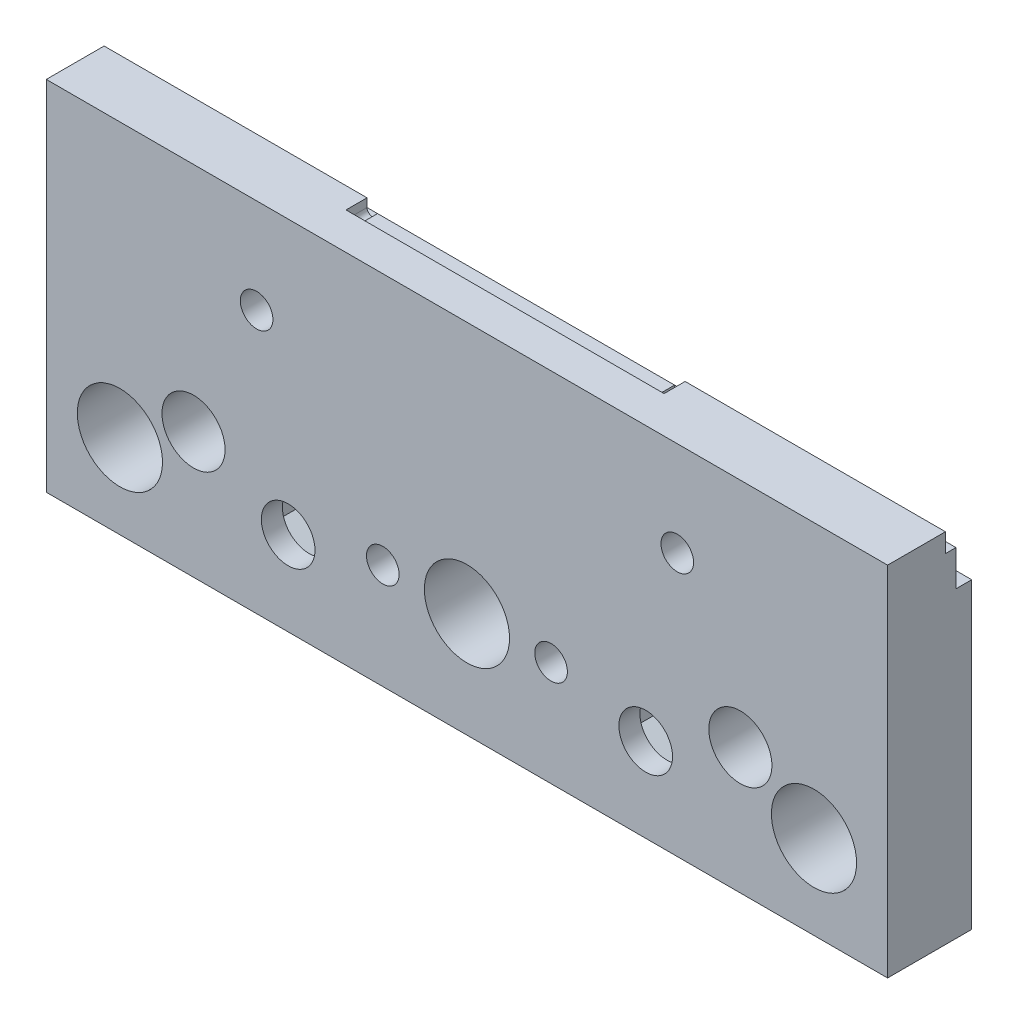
SolidWorks part; units mm, degrees
ref_plane "前视基准面" through (0, 0, 0) normal (0, 0, 1) x (1, 0, 0)
ref_plane "上视基准面" through (0, 0, 0) normal (0, 1, 0) x (1, 0, 0)
ref_plane "右视基准面" through (0, 0, 0) normal (1, 0, 0) x (0, 0, -1)
sketch "前视图草图" plane through (0, 0, 0) normal (0, 0, 1) x (1, 0, 0)
  line L0 (0, 0) -> (44.4821, 0) construction
  line L1 (0, 0) -> (0, 28.3185) construction
sketch "草图2" plane through (0, 0, 0) normal (0, 0, 1) x (1, 0, 0)
  line L0 (0, 0) -> (80, 0)
  line L1 (-200000, 0) -> (200044.4821, 0) construction
  line L2 (80, 0) -> (80, 34)
  line L3 (80, 34) -> (0, 34)
  line L4 (0, -200000) -> (0, 200028.3185) construction
  line L5 (0, 34) -> (0, 0)
  circle A0 centre (7, 8) radius 4.05
  circle A1 centre (40, 10) radius 4.05
  circle A2 centre (73, 8) radius 4.05
  dimension "D3" = 8
  dimension "D5" = 10
  dimension "D9" = 8.1
  dimension "D10" = 8.1
  dimension "D11" = 8.1
  dimension "D1" = 34
  dimension "D2" = 80
  dimension "D4" = 7
  dimension "D6" = 7
  dimension "D7" = 8
  dimension "D8" = 40
extrude "凸台-拉伸1" add sketch "草图2" along normal blind 8
sketch "草图3" plane through (0, 0, 8) normal (0, 0, 1) x (1, 0, 0)
  line L0 (16.088, 8) -> (31.4805, 8) construction
  line L1 (7, 8) -> (7, 16.8386) construction
  line L2 (73, 8) -> (73, 16.5917) construction
  line L4 (-200000, 0) -> (200044.4821, 0) construction
  circle A2 centre (23, 8) radius 2.55
  circle A3 centre (57, 8) radius 2.55
  dimension "D4" = 5.1
  dimension "D5" = 5.1
  dimension "D1" = 8
  dimension "D2" = 16
  dimension "D3" = 16
extrude "切除-拉伸1" cut sketch "草图3" against normal through all
sketch "草图4" plane through (80, 0, 0) normal (1, 0, 0) x (0, 0, -1)
  line L1 (0, -200000) -> (0, 200028.3185) construction
  line L2 (-1.5, 32.2) -> (-2.5, 32.2)
  line L3 (-2.5, 32.2) -> (-2.5, 34)
  line L4 (-8, 34) -> (0, 34) construction
  line L5 (-2.5, 34) -> (0, 34)
  line L6 (-1.5, 32.2) -> (-1.5, 28.8)
  line L7 (-1.5, 28.8) -> (0, 28.8)
  line L8 (0, 28.8) -> (0, 34)
  dimension "D1" = 3.4
  dimension "D2" = 2.5
  dimension "D3" = 1.5
  dimension "D4" = 1.8
extrude "切除-拉伸2" cut sketch "草图4" against normal through all
sketch "草图5" plane through (0, 0, 8) normal (0, 0, 1) x (1, 0, 0)
  line L0 (40, 10) -> (56.5376, 10) construction
  circle A0 centre (40, 10) radius 8 construction
  circle A1 centre (48, 10) radius 1.55
  circle A2 centre (32, 10) radius 1.55
  dimension "D1" = 3.1
  dimension "D2" = 3.1
  dimension "D3" = 16
extrude "切除-拉伸3" cut sketch "草图5" against normal through all
sketch "草图7" plane through (0, 0, 0) normal (0, 0, -1) x (-1, 0, 0)
  line L0 (-40, 12) -> (-40, -8.3696) construction
  line L1 (-23, 10) -> (-23, -2.3368) construction
  line L2 (200000, 0) -> (-200044.4821, 0) construction
  line L6 (-27.05, 10) -> (-27.05, 2.5)
  line L7 (-29.55, 0) -> (-16.45, 0)
  line L8 (-18.95, 2.5) -> (-18.95, 10)
  line L9 (-23, 8) -> (-23, 15.9045) construction
  line L13 (0, -200000) -> (0, 200028.3185) construction
  line L14 (-57, 8) -> (-57, 15.9045) construction
  line L15 (-57, 10) -> (-57, -2.3368) construction
  line L16 (-61.05, 2.5) -> (-61.05, 10)
  line L17 (-50.45, 0) -> (-63.55, 0)
  line L18 (-52.95, 10) -> (-52.95, 2.5)
  arc A1 (-18.95, 10) -> (-27.05, 10) centre (-23, 10) ccw
  arc A4 (-29.55, 0) -> (-27.05, 2.5) centre (-29.55, 2.5) ccw
  arc A5 (-18.95, 2.5) -> (-16.45, 0) centre (-16.45, 2.5) ccw
  arc A7 (-61.05, 2.5) -> (-63.55, 0) centre (-63.55, 2.5) cw
  arc A8 (-50.45, 0) -> (-52.95, 2.5) centre (-50.45, 2.5) cw
  arc A9 (-61.05, 10) -> (-52.95, 10) centre (-57, 10) cw
  dimension "D1" = 40
  dimension "D4" = 8.1
  dimension "D7" = 2.5
  dimension "D8" = 2.5
  dimension "D3" = 10
extrude "切除-拉伸4" [suppressed] cut sketch "草图7" against normal blind 6
sketch "草图8" plane through (0, 0, 0) normal (0, 0, -1) x (-1, 0, 0)
  line L0 (-40, 10) -> (-57.3165, 10) construction
  line L1 (-40, 20) -> (-40, 35.6562) construction
  line L2 (-30.5, 12.85) -> (-49.5, 12.85)
  line L3 (-49.5, 7.15) -> (-30.5, 7.15)
  line L4 (200000, 0) -> (-200044.4821, 0) construction
  line L5 (-80, 0) -> (-80, 28.8) construction
  line L6 (-48, 6.7091) -> (-45.15, 8.3546)
  line L7 (-45.15, 8.3546) -> (-45.15, 11.6454)
  line L8 (-45.15, 11.6454) -> (-48, 13.2909)
  line L9 (-48, 13.2909) -> (-50.85, 11.6454)
  line L10 (-50.85, 11.6454) -> (-50.85, 8.3546)
  line L11 (-50.85, 8.3546) -> (-48, 6.7091)
  line L12 (-34.85, 11.6454) -> (-34.85, 8.3546)
  line L13 (-34.85, 8.3546) -> (-32, 6.7091)
  line L14 (-32, 6.7091) -> (-29.15, 8.3546)
  line L15 (-29.15, 8.3546) -> (-29.15, 11.6454)
  line L16 (-29.15, 11.6454) -> (-32, 13.2909)
  line L17 (-32, 13.2909) -> (-34.85, 11.6454)
  arc A0 (-30.5, 7.15) -> (-30.5, 12.85) centre (-30.5, 10) ccw
  arc A1 (-49.5, 12.85) -> (-49.5, 7.15) centre (-49.5, 10) ccw
  circle A2 centre (-48, 10) radius 2.85 construction
  circle A3 centre (-32, 10) radius 2.85 construction
  dimension "D1" = 5.7
  dimension "D2" = 9.5
  dimension "D3" = 9.5
  dimension "D4" = 10
  dimension "D5" = 5.7
sketch "草图11" plane through (0, 0, 0) normal (0, 0, -1) x (-1, 0, 0)
  line L0 (0, 34) -> (-80, 34) construction
  line L1 (-80, 0) -> (-80, 28.8) construction
  line L2 (0, -200000) -> (0, 200028.3185) construction
  line L3 (-40, 20) -> (-40, 13.5744) construction
  line L4 (-28.772, 25) -> (-45.9396, 25) construction
  circle A0 centre (-60, 25) radius 1.55
  circle A1 centre (-20, 25) radius 1.55
  point P23 (-40, 20)
  dimension "D1" = 3.1
  dimension "D2" = 3.1
  dimension "D3" = 20
  dimension "D4" = 20
  dimension "D5" = 9
sketch "草图20" plane through (0, 0, 0) normal (0, 0, -1) x (-1, 0, 0)
  circle A0 centre (-40, 10) radius 5.5
  dimension "D1" = 11
extrude "切除-拉伸15" cut sketch "草图8" against normal blind 4.5 contours L10 L11 L6 L7 L8 L9 | L13 L14 L15 L16 L17 L12
extrude "切除-拉伸7" cut sketch "草图11" against normal through all contours A0 | A1
sketch "草图12" plane through (0, 0, 0) normal (0, 0, -1) x (-1, 0, 0)
  line L0 (-62.5, 22.15) -> (-57.5, 22.15)
  line L1 (-57.5, 27.85) -> (-62.5, 27.85)
  line L4 (-80, 0) -> (-80, 28.8) construction
  line L5 (-39.1423, 25) -> (-43.2672, 25) construction
  line L6 (-60, 21) -> (-60, 25.2385) construction
  line L7 (-20, 21) -> (-20, 26.1603) construction
  line L8 (-40, 20) -> (-40, 24.3689) construction
  line L9 (-17.5, 27.85) -> (-22.5, 27.85)
  line L10 (-22.5, 22.15) -> (-17.5, 22.15)
  line L11 (0, -200000) -> (0, 200028.3185) construction
  line L12 (0, 34) -> (-80, 34) construction
  arc A0 (-62.5, 27.85) -> (-62.5, 22.15) centre (-62.5, 25) ccw
  arc A1 (-57.5, 22.15) -> (-57.5, 27.85) centre (-57.5, 25) ccw
  arc A4 (-17.5, 22.15) -> (-17.5, 27.85) centre (-17.5, 25) ccw
  arc A5 (-22.5, 27.85) -> (-22.5, 22.15) centre (-22.5, 25) ccw
  point P16 (-38, 21)
  point P28 (-40, 25)
  dimension "D2" = 20
  dimension "D3" = 5
  dimension "D4" = 2.5
  dimension "D5" = 20
  dimension "D6" = 9
  dimension "D1" = 2
sketch "草图19" plane through (0, 0, 2.5) normal (0, 0, -1) x (-1, 0, 0)
  line L0 (0, 34) -> (-80, 34) construction
  line L1 (-25, 34) -> (-55.2479, 34)
  line L2 (-25, 34) -> (-25, 33.2)
  line L3 (-26, 33.2) -> (-54.2479, 33.2)
  line L4 (-55.2479, 34) -> (-55.2479, 33.2)
  line L5 (0, -200000) -> (0, 200028.3185) construction
  line L7 (0, 32.2) -> (-80, 32.2) construction
  line L8 (-56.3335, 32.7) -> (-52.9089, 32.7) construction
  line L9 (-55.2479, 1028.5823) -> (-55.2479, 33.2) construction
  line L10 (-25, 1028.5823) -> (-25, 32.7) construction
  line L11 (-55.2479, 32.7) -> (-55.2479, -973.3) construction
  line L12 (-25, 32.7) -> (-25, -973.3) construction
  arc A3 (-55.2479, 33.2) -> (-54.2479, 33.2) centre (-54.7479, 33.2) ccw
  arc A6 (-26, 33.2) -> (-25, 33.2) centre (-25.5, 33.2) ccw
  dimension "D3" = 1
  dimension "D4" = 1
  dimension "D2" = 0.8
  dimension "D1" = 0.5
  dimension "D9" = 25
extrude "切除-拉伸11" cut sketch "草图19" against normal blind 2
sketch "草图21" plane through (0, 0, 0) normal (0, 0, -1) x (-1, 0, 0)
  line L0 (-80, 12) -> (0, 12) construction
  line L1 (-80, 0) -> (-80, 28.8) construction
  line L2 (0, -200000) -> (0, 200028.3185) construction
  line L3 (-66, 28.8) -> (-66, 0) construction
  line L4 (0, 28.8) -> (-80, 28.8) construction
  line L5 (200000, 0) -> (-200044.4821, 0) construction
  line L6 (-40, 28.8) -> (-40, 0) construction
  line L7 (-40, -199980) -> (-40, 200024.3689) construction
  circle A0 centre (-66, 12) radius 3
  circle A1 centre (-14, 12) radius 3
  dimension "D3" = 6
  dimension "D1" = 12
  dimension "D2" = 14
extrude "切除-拉伸13" cut sketch "草图21" against normal through all
sketch "草图22" plane through (0, 0, 0) normal (0, 0, -1) x (-1, 0, 0)
  line L0 (-80, 0) -> (-80, 28.8) construction
  line L1 (-52.9, 5.6329) -> (-52.9, 10.3671)
  line L2 (-52.9, 10.3671) -> (-57, 12.7343)
  line L3 (-57, 12.7343) -> (-61.1, 10.3671)
  line L4 (-61.1, 10.3671) -> (-61.1, 5.6329)
  line L5 (-61.1, 5.6329) -> (-57, 3.2657)
  line L6 (-57, 3.2657) -> (-52.9, 5.6329)
  line L7 (-23, 3.2657) -> (-18.9, 5.6329)
  line L8 (-18.9, 5.6329) -> (-18.9, 10.3671)
  line L9 (-18.9, 10.3671) -> (-23, 12.7343)
  line L10 (-23, 12.7343) -> (-27.1, 10.3671)
  line L11 (-27.1, 10.3671) -> (-27.1, 5.6329)
  line L12 (-27.1, 5.6329) -> (-23, 3.2657)
  circle A0 centre (-57, 8) radius 4.1 construction
  circle A1 centre (-23, 8) radius 4.1 construction
  dimension "D1" = 8.2
extrude "切除-拉伸14" cut sketch "草图22" against normal blind 6
